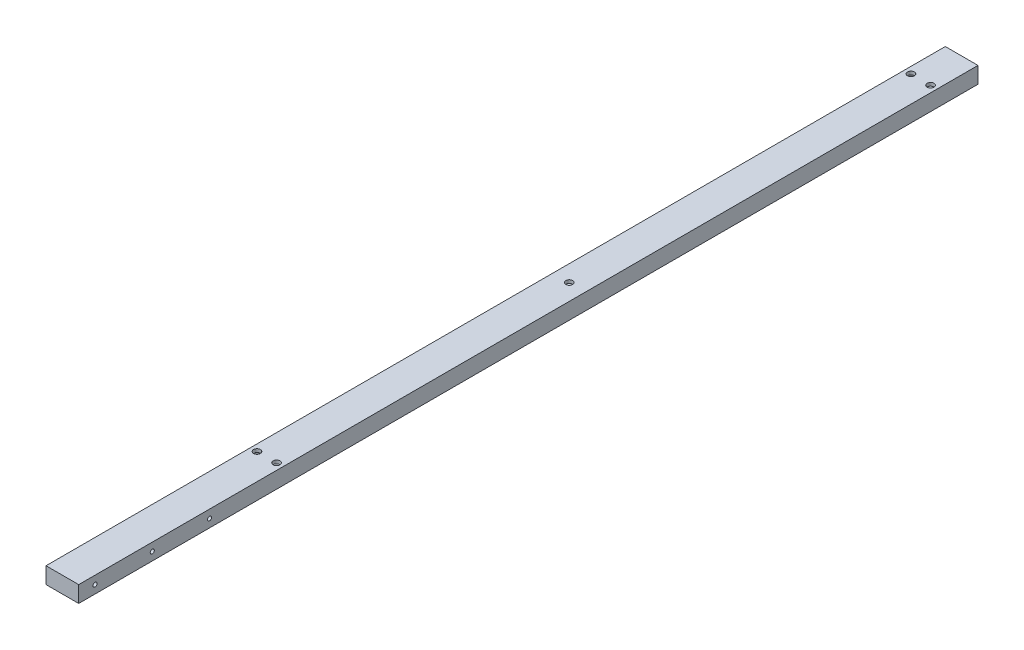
SolidWorks part; units mm, degrees
ref_plane "前视基准面" through (0, 0, 0) normal (0, 0, 1) x (1, 0, 0)
ref_plane "上视基准面" through (0, 0, 0) normal (0, 1, 0) x (1, 0, 0)
ref_plane "右视基准面" through (0, 0, 0) normal (1, 0, 0) x (0, 0, -1)
sketch "草图1" plane through (0, 0, 0) normal (0, 0, 1) x (1, 0, 0)
  line L1 (-10, 5) -> (10, 5)
  line L2 (-10, 5) -> (-10, -5)
  line L3 (-10, -5) -> (10, -5)
  line L4 (10, 5) -> (10, -5)
  line L5 (-10, 5) -> (10, -5) construction
  line L6 (-10, -5) -> (10, 5) construction
  line L7 (-8, 3) -> (8, 3)
  line L8 (-8, 3) -> (-8, -3)
  line L9 (-8, -3) -> (8, -3)
  line L10 (8, 3) -> (8, -3)
  line L11 (-8, 3) -> (8, -3) construction
  line L12 (-8, -3) -> (8, 3) construction
  point P0 (0, 0)
  point P6 (0, 0)
  dimension "D1" = 20
  dimension "D2" = 10
  dimension "D3" = 2
  dimension "D4" = 2
extrude "凸台-拉伸1" add sketch "草图1" along normal blind 450
hole_wizard "Ø4.2 (4.2) 直径孔1" positions "草图2" profile "草图3" hole size "Ø4.2" standard "GB"
sketch "草图2" plane through (0, 5, 0) normal (0, 1, 0) x (1, 0, 0)
  line L0 (10, -450) -> (10, 0) construction
  point P0 (-6, -425)
  point P2 (6, -425)
  point P4 (-6, -25)
  point P6 (6, -25)
  point P11 (10, -225)
  dimension "D1" = 400
  dimension "D2" = 200
  dimension "D3" = 12
  dimension "D4" = 12
  dimension "D5" = 6
  dimension "D6" = 6
sketch "草图3" plane through (-6, 5, 425) normal (1, 0, 0) x (0, 0, 1)
  line L0 (0, 0) -> (0, 10)
  line L1 (0, 10) -> (2.1, 10)
  line L2 (2.1, 10) -> (2.1, 0)
  line L5 (2.1, 0) -> (0, 0)
  line L11 (0, -6.35) -> (0, 107.95) construction
  dimension "通孔孔直径" = 4.2
  dimension "通孔孔深度" = 10
hole_wizard "Ø4.2 (4.2) 直径孔2" positions "草图4" profile "草图5" hole size "Ø4.2" standard "GB"
sketch "草图4" plane through (0, -5, 0) normal (0, -1, 0) x (-1, 0, 0)
  line L1 (-10, -450) -> (-10, 0) construction
  line L2 (-10, -450) -> (10, -450) construction
  point P0 (0, -240)
  dimension "D1" = 10
  dimension "D2" = 210
sketch "草图5" plane through (0, -5, 240) normal (1, 0, 0) x (0, 0, -1)
  line L0 (0, 0) -> (0, 10)
  line L1 (0, 10) -> (2.1, 10)
  line L2 (2.1, 10) -> (2.1, 0)
  line L5 (2.1, 0) -> (0, 0)
  line L11 (0, -6.35) -> (0, 107.95) construction
  dimension "通孔孔直径" = 4.2
  dimension "通孔孔深度" = 10
sketch "草图8" plane through (0, 0, 450) normal (0, 0, -1) x (-1, 0, 0)
  line L1 (-10, 5) -> (10, 5)
  line L2 (-10, 5) -> (-10, -5)
  line L3 (-10, -5) -> (10, -5)
  line L4 (10, 5) -> (10, -5)
  line L5 (-10, 5) -> (10, -5) construction
  line L6 (-10, -5) -> (10, 5) construction
  point P0 (0, 0)
  dimension "D1" = 20
  dimension "D2" = 10
extrude "凸台-拉伸2" add sketch "草图8" against normal blind 100
hole_wizard "Ø2.5 (2.5) 直径孔1" positions "草图10" profile "草图11" hole size "Ø2.5" standard "GB"
sketch "草图10" plane through (-10, 0, 0) normal (-1, 0, 0) x (0, 0, 1)
  point P0 (540, 0)
  point P3 (505, 0)
  point P6 (470, 0)
sketch "草图11" plane through (-10, 0, 540) normal (0, 1, 0) x (0, 0, 1)
  line L0 (0, 0) -> (0, 20)
  line L1 (0, 20) -> (1.25, 20)
  line L2 (1.25, 20) -> (1.25, 0)
  line L5 (1.25, 0) -> (0, 0)
  line L11 (0, -6.35) -> (0, 107.95) construction
  dimension "通孔孔直径" = 2.5
  dimension "通孔孔深度" = 20
